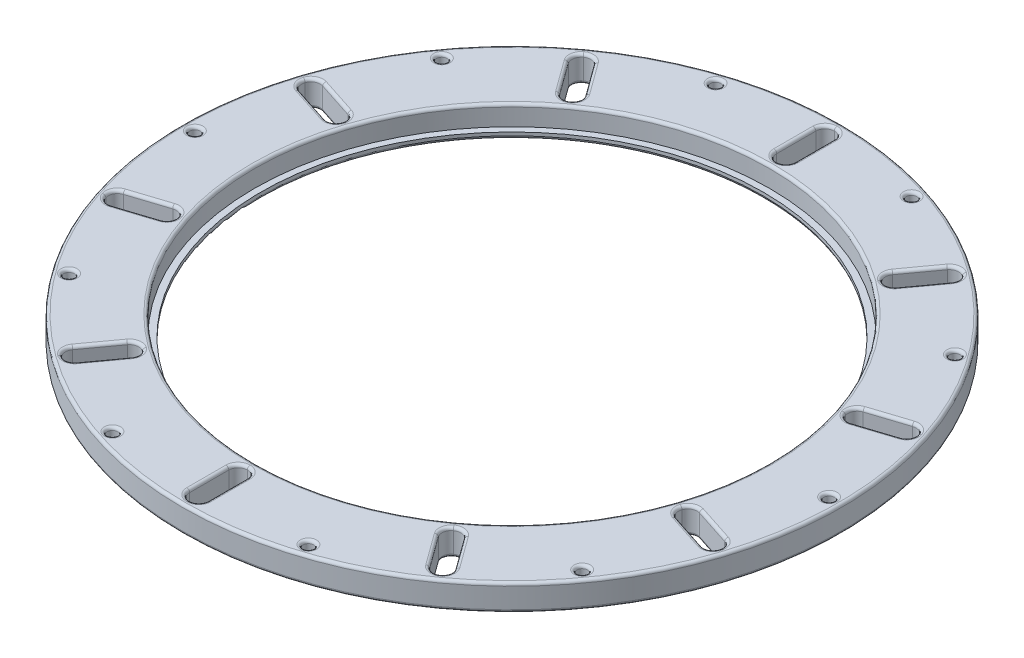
SolidWorks part; units mm, degrees
ref_plane "Front Plane" through (0, 0, 0) normal (0, 0, 1) x (1, 0, 0)
ref_plane "Top Plane" through (0, 0, 0) normal (0, 1, 0) x (1, 0, 0)
ref_plane "Right Plane" through (0, 0, 0) normal (1, 0, 0) x (0, 0, -1)
body saved out of another part "Stock-new goddard iris-1"
